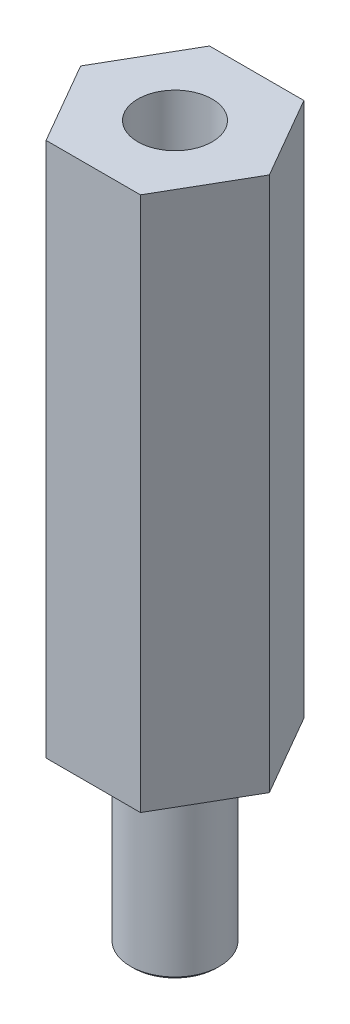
SolidWorks part; units mm, degrees
ref_plane "Спереди" through (0, 0, 0) normal (0, 0, 1) x (1, 0, 0)
ref_plane "Сверху" through (0, 0, 0) normal (0, 1, 0) x (1, 0, 0)
ref_plane "Справа" through (0, 0, 0) normal (1, 0, 0) x (0, 0, -1)
sketch "Эскиз1" plane through (0, 0, 0) normal (0, 1, 0) x (1, 0, 0)
  line L1 (3.1754, 0) -> (1.5877, 2.75)
  line L2 (1.5877, 2.75) -> (-1.5877, 2.75)
  line L3 (-1.5877, 2.75) -> (-3.1754, 0)
  line L4 (-3.1754, 0) -> (-1.5877, -2.75)
  line L5 (-1.5877, -2.75) -> (1.5877, -2.75)
  line L6 (1.5877, -2.75) -> (3.1754, 0)
  circle A0 centre (0, 0) radius 2.75 construction
  circle A1 centre (0, 0) radius 1.25
  dimension "D2" = 2.5
  dimension "D1" = 5.5
extrude "Бобышка-Вытянуть1" add sketch "Эскиз1" along normal blind 18
sketch "Эскиз2" plane through (0, 0, 0) normal (0, -1, 0) x (1, 0, 0)
  circle A0 centre (0, 0) radius 1.5
  dimension "D1" = 3
extrude "Бобышка-Вытянуть2" add sketch "Эскиз2" along normal blind 6
chamfer "Фаска1" distance 0.1 angle 45 1 edges at (0, -6, -1.5)
